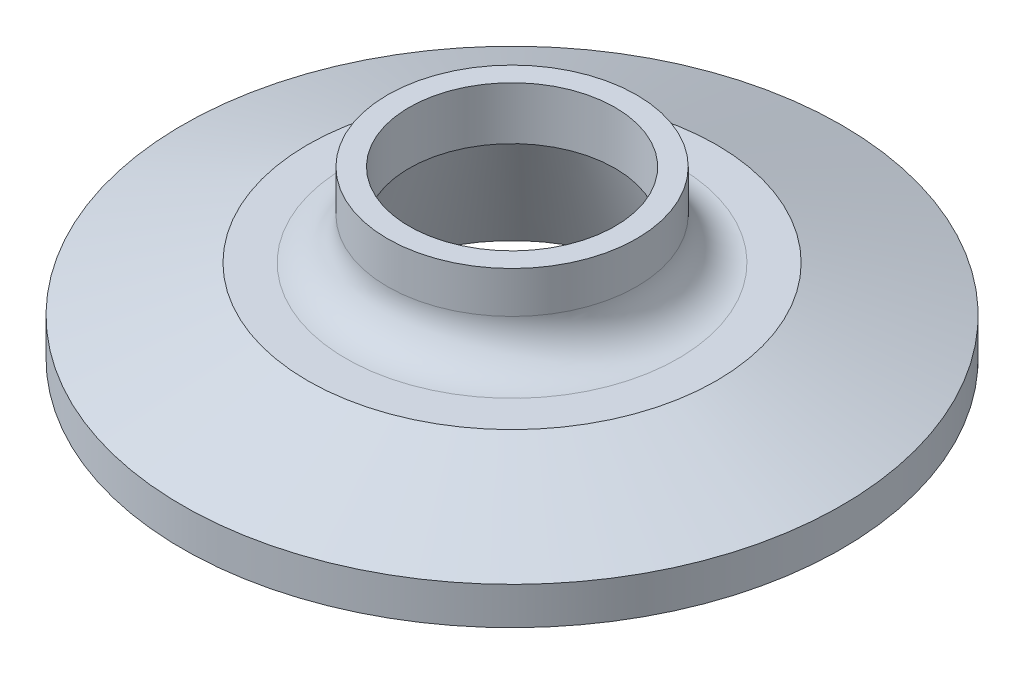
SolidWorks part; units mm, degrees
ref_plane "Front Plane" through (0, 0, 0) normal (0, 0, 1) x (1, 0, 0)
ref_plane "Top Plane" through (0, 0, 0) normal (0, 1, 0) x (1, 0, 0)
ref_plane "Right Plane" through (0, 0, 0) normal (1, 0, 0) x (0, 0, -1)
sketch "Sketch1" plane through (0, 0, 0) normal (0, 0, 1) x (1, 0, 0)
  line L0 (0, 0) -> (0, 8.8532) construction
  line L1 (-9.525, 12.7) -> (-9.525, 9.525)
  line L2 (-12.7, 6.35) -> (-15.6302, 6.35)
  line L3 (-15.6302, 6.35) -> (-25.1968, 2.868)
  line L4 (-25.1968, 2.868) -> (-25.1968, 0)
  line L5 (-25.1968, 0) -> (-23.8092, 0)
  line L6 (-19.828, 0) -> (-11.049, 0)
  line L10 (-11.049, 0) -> (-7.874, 8.6667)
  line L11 (-7.874, 8.6667) -> (-7.874, 12.7)
  line L12 (-7.874, 12.7) -> (-9.525, 12.7)
  line L15 (-22.9175, 0.8729) -> (-23.0844, 0.4797)
  line L17 (-20.7197, 0.8729) -> (-20.5528, 0.4797)
  arc A0 (-12.7, 6.35) -> (-9.525, 9.525) centre (-12.7, 9.525) ccw
  arc A1 (-23.0844, 0.4797) -> (-23.8092, 0) centre (-23.8092, 0.7874) cw
  arc A2 (-19.828, 0) -> (-20.5528, 0.4797) centre (-19.828, 0.7874) cw
  arc A3 (-20.7197, 0.8729) -> (-22.9175, 0.8729) centre (-21.8186, 0.4064) ccw
  dimension "D3" = 3.175
  dimension "D7" = 0.7874
  dimension "D8" = 21.8186
  dimension "D9" = 0.7874
  dimension "D2" = 7.874
  dimension "D4" = 12.7
  dimension "D5" = 6.35
  dimension "D6" = 25.1968
  dimension "D10" = 20
  dimension "D11" = 11.049
  dimension "D12" = 9.525
  dimension "D13" = 20.12
revolve "Revolve1" add sketch "Sketch1" angle 360 about L0
